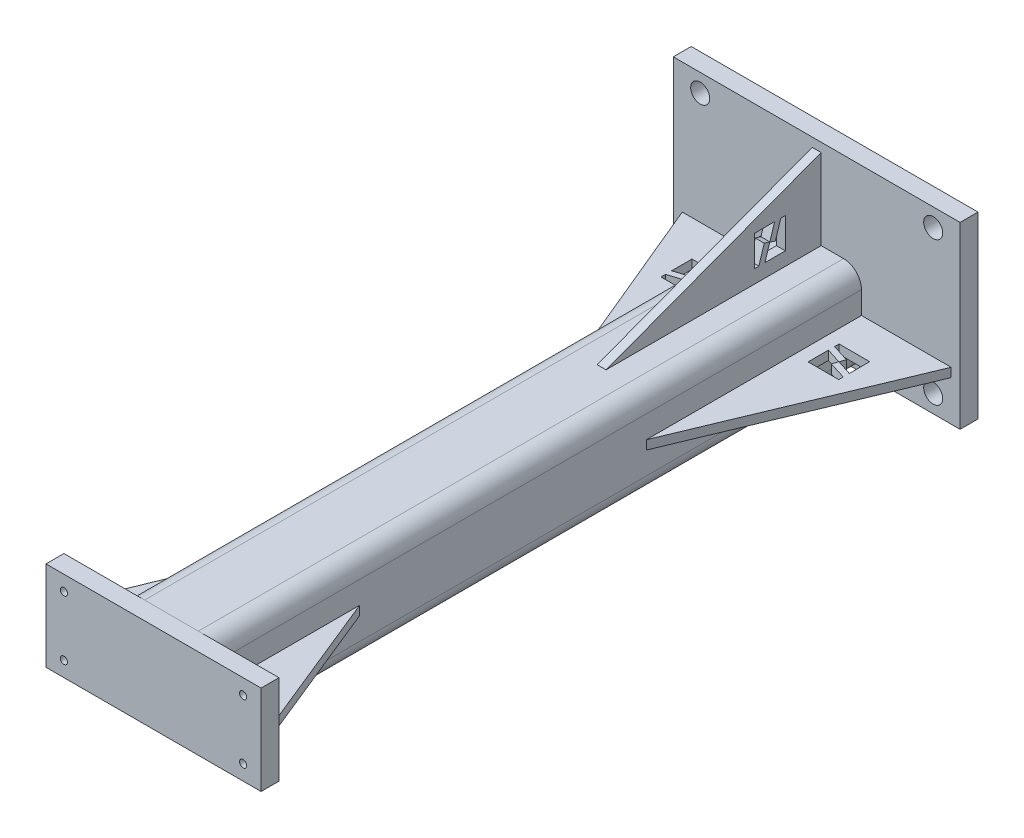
SolidWorks part; units mm, degrees
ref_plane "Front Plane" through (0, 0, 0) normal (0, 0, 1) x (1, 0, 0)
ref_plane "Top Plane" through (0, 0, 0) normal (0, 1, 0) x (1, 0, 0)
ref_plane "Right Plane" through (0, 0, 0) normal (1, 0, 0) x (0, 0, -1)
sketch3d "3DSketch1"
  line L0 (0, 0, 0) -> (0, 0, -457.2)
  dimension "D3" = 457.2
other "Tube (square) TS2.5X2.5X0.25(13)"
ref_plane "Plane1" through (0, 0, 0) normal (0, 0, -1) x (1, 0, 0)
sketch "Sketch131" plane through (0, 0, 0) normal (0, 0, -1) x (1, 0, 0)
  line L0 (-19.05, -25.4) -> (19.05, -25.4)
  line L1 (-25.4, -19.05) -> (-25.4, 19.05)
  line L2 (19.05, 25.4) -> (-19.05, 25.4)
  line L3 (25.4, 19.05) -> (25.4, -19.05)
  line L4 (-19.05, -31.75) -> (19.05, -31.75)
  line L5 (-31.75, -19.05) -> (-31.75, 19.05)
  line L6 (19.05, 31.75) -> (-19.05, 31.75)
  line L7 (31.75, 19.05) -> (31.75, -19.05)
  line L8 (-31.75, 0) -> (-25.4, 0) construction
  line L9 (-25.4, 0) -> (25.4, 0) construction
  line L10 (25.4, 0) -> (31.75, 0) construction
  line L11 (0, 31.75) -> (0, 25.4) construction
  line L12 (0, 25.4) -> (0, -25.4) construction
  line L13 (0, -25.4) -> (0, -31.75) construction
  arc A0 (31.75, 19.05) -> (19.05, 31.75) centre (19.05, 19.05) ccw
  arc A1 (19.05, -31.75) -> (31.75, -19.05) centre (19.05, -19.05) ccw
  arc A2 (-31.75, -19.05) -> (-19.05, -31.75) centre (-19.05, -19.05) ccw
  arc A3 (-19.05, 31.75) -> (-31.75, 19.05) centre (-19.05, 19.05) ccw
  arc A4 (-19.05, 25.4) -> (-25.4, 19.05) centre (-19.05, 19.05) ccw
  arc A5 (25.4, 19.05) -> (19.05, 25.4) centre (19.05, 19.05) ccw
  arc A6 (19.05, -25.4) -> (25.4, -19.05) centre (19.05, -19.05) ccw
  arc A7 (-25.4, -19.05) -> (-19.05, -25.4) centre (-19.05, -19.05) ccw
  point P6 (-31.75, -31.75)
  point P33 (-31.75, 31.75)
  point P35 (31.75, 31.75)
  point P36 (31.75, -31.75)
  point P37 (0, 0)
  dimension "D1" = 12.7
  dimension "Thickness" = 6.35
  dimension "V_leg" = 63.5
  dimension "H_leg" = 63.5
other "End cap1" [suppressed] parameters "D1"=6.35, "D2"=3.175, "D3"=3.175, "D4"=0
sketch "Sketch12" plane through (0, 0, -457.2) normal (0, 0, -1) x (-1, 0, 0)
  line L0 (0, 95.25) -> (0, -31.75) construction
  line L1 (19.05, 31.75) -> (-19.05, 31.75) construction
  line L3 (-19.05, -31.75) -> (19.05, -31.75) construction
  line L4 (-101.6, 95.25) -> (101.6, 95.25)
  line L5 (-101.6, 95.25) -> (-101.6, -31.75)
  line L6 (-101.6, -31.75) -> (101.6, -31.75)
  line L7 (101.6, 95.25) -> (101.6, -31.75)
  line L8 (-101.6, 95.25) -> (101.6, -31.75) construction
  line L9 (-101.6, -31.75) -> (101.6, 95.25) construction
  line L12 (0, 381.889) -> (0, 31.75) construction
  point P6 (0, 31.75)
  dimension "D1" = 127
  dimension "D2" = 203.2
extrude "Boss-Extrude1" add sketch "Sketch12" along normal blind 12.7 separate body
hole_wizard "1/2 Clearance Hole1" positions "Sketch13" profile "Sketch14" hole size "1/2" standard "ANSI Inch"
sketch "Sketch13" plane through (0, 0, -457.2) normal (0, 0, 1) x (1, 0, 0)
  line L0 (-101.6, 31.75) -> (299.7541, 31.75) construction
  line L1 (-101.6, -31.75) -> (-101.6, 95.25) construction
  line L3 (0, -31.75) -> (0, 201.525) construction
  line L4 (101.6, -31.75) -> (-101.6, -31.75) construction
  line L6 (-101.6, 95.25) -> (101.6, 95.25) construction
  point P0 (-82.55, 82.55)
  point P17 (-82.55, -19.05)
  point P19 (82.55, -19.05)
  point P20 (82.55, 82.55)
  dimension "D1" = 19.05
  dimension "D2" = 12.7
sketch "Sketch14" plane through (-82.55, 82.55, -457.2) normal (1, 0, 0) x (0, -1, 0)
  line L0 (0, 0) -> (0, 12.7)
  line L1 (0, 12.7) -> (6.7462, 12.7)
  line L2 (6.7462, 12.7) -> (6.7462, 0)
  line L5 (6.7462, 0) -> (0, 0)
  line L11 (0, -6.35) -> (0, 107.95) construction
  dimension "Thru Hole Dia." = 13.4925
  dimension "Thru Hole Depth" = 12.7
move or copy body "Body-Move/Copy1" [suppressed] bodies to move or copy 105 copy no translate (-31.75, 0, 0)
mirror "Mirror6" [suppressed] about plane through (0, 0, 0) normal (1, 0, 0)
other "Gusset1" parameters "D1"=6.35, "D2"=6.35, "D3"=0, "D4"=0, "D10"=6.35, "D11"=152.4, "D12"=63.5, "D13"=12.7, "D14"=67.751, "D15"=12.7, "D16"=76.2, "D17"=34.925, "D18"=24.624
sketch "Sketch132" plane through (-31.75, 0, -457.2) normal (0, -1, 0) x (-1, 0, 0)
  line L0 (0, 0) -> (0, -152.4)
  line L1 (0, 0) -> (63.5, 0)
  line L2 (0, -152.4) -> (63.5, 0)
sketch "Sketch134" plane through (0, 3.175, 0) normal (0, 1, 0) x (1, 0, 0)
  line L0 (-95.25, 457.2) -> (-31.75, 457.2) construction
  line L1 (-31.75, 457.2) -> (-31.75, 304.8) construction
  line B0 (-52.0238, 420.8344) -> (-50.8144, 416.8466)
  line B1 (-50.8144, 416.8466) -> (-62.9753, 413.011)
  line B2 (-62.9753, 413.011) -> (-62.9753, 409.814)
  line B3 (-62.9753, 409.814) -> (-41.275, 409.814)
  line B4 (-41.275, 409.814) -> (-41.275, 424.2507)
  line B5 (-41.275, 424.2507) -> (-52.0238, 420.8344)
  line B6 (-52.2366, 420.764) -> (-53.4409, 424.7518)
  line B7 (-53.4409, 424.7518) -> (-41.275, 428.5875)
  line B8 (-41.275, 428.5875) -> (-41.275, 431.8)
  line B9 (-41.275, 431.8) -> (-62.9694, 431.8)
  line B10 (-62.9694, 431.8) -> (-63.0073, 417.3555)
  line B11 (-63.0073, 417.3555) -> (-52.2366, 420.764)
  dimension "D1" = 25.4
  dimension "D2" = 9.525
sketch_block_instance "Block2-1"
sketch_block "Block2"
extrude "Cut-Extrude1" cut sketch "Sketch134" against normal through all
other "Gusset2" parameters "D1"=6.35, "D2"=6.35, "D3"=0, "D4"=0, "D10"=6.35, "D11"=152.4, "D12"=57.15, "D13"=12.7, "D14"=74.745, "D15"=12.7, "D16"=76.2, "D17"=31.75, "D18"=22.62
sketch "Sketch133" plane through (0, 31.75, -457.2) normal (-1, 0, 0) x (0, 0, 1)
  line L0 (0, 0) -> (152.4, 0)
  line L1 (0, 0) -> (0, 57.15)
  line L2 (152.4, 0) -> (0, 57.15)
sketch "Sketch135" plane through (-3.175, 0, 0) normal (-1, 0, 0) x (0, 0, 1)
  line L0 (-457.2, 88.9) -> (-457.2, 31.75) construction
  line L1 (-457.2, 31.75) -> (-304.8, 31.75) construction
  line B0 (-420.7796, 52.0238) -> (-424.7675, 50.8144)
  line B1 (-424.7675, 50.8144) -> (-428.6031, 62.9753)
  line B2 (-428.6031, 62.9753) -> (-431.8, 62.9753)
  line B3 (-431.8, 62.9753) -> (-431.8, 41.275)
  line B4 (-431.8, 41.275) -> (-417.3633, 41.275)
  line B5 (-417.3633, 41.275) -> (-420.7796, 52.0238)
  line B6 (-420.8501, 52.2366) -> (-416.8622, 53.4409)
  line B7 (-416.8622, 53.4409) -> (-413.0266, 41.275)
  line B8 (-413.0266, 41.275) -> (-409.814, 41.275)
  line B9 (-409.814, 41.275) -> (-409.814, 62.9694)
  line B10 (-409.814, 62.9694) -> (-424.2585, 63.0073)
  line B11 (-424.2585, 63.0073) -> (-420.8501, 52.2366)
  dimension "D1" = 25.4
  dimension "D2" = 9.525
sketch_block_instance "Block2-2"
extrude "Cut-Extrude2" cut sketch "Sketch135" against normal through all
ref_plane "Plane2" through (0, 0, 0) normal (-1, 0, 0) x (0, 0, 1)
mirror "Mirror3" about plane through (0, 0, 0) normal (-1, 0, 0)
sketch "Sketch136" plane through (0, 0, 0) normal (0, 0, 1) x (1, 0, 0)
  line L0 (-19.05, 31.75) -> (19.05, 31.75) construction
  line L1 (19.05, -31.75) -> (-19.05, -31.75) construction
  line L2 (0, -25.4) -> (0, -31.75) construction
  line L3 (19.05, -25.4) -> (-19.05, -25.4) construction
  line L8 (-76.2, 31.75) -> (-76.2, -31.75)
  line L9 (-76.2, -31.75) -> (76.2, -31.75)
  line L10 (76.2, -31.75) -> (76.2, 31.75)
  line L11 (76.2, 31.75) -> (-76.2, 31.75)
  dimension "D1" = 152.4
extrude "Boss-Extrude2" add sketch "Sketch136" along normal blind 12.7 separate body
hole_wizard "#10 Clearance Hole1" positions "Sketch137" profile "Sketch138" hole size "#10" standard "ANSI Inch"
sketch "Sketch137" plane through (0, 0, 0) normal (0, 0, -1) x (-1, 0, 0)
  line L0 (63.5, 21.0312) -> (-76.2, 21.0312) construction
  line L2 (-76.2, 26.1112) -> (-76.2, 15.9512) construction
  line L3 (-76.2, -21.0312) -> (63.5, -21.0312) construction
  line L5 (-76.2, -15.9512) -> (-76.2, -26.1112) construction
  line L6 (63.5, 21.0312) -> (63.5, -21.0312) construction
  line L8 (76.2, 31.75) -> (76.2, -31.75) construction
  point P0 (63.5, 21.0312)
  point P2 (63.5, -21.0312)
  dimension "D1" = 12.7
sketch "Sketch138" plane through (-63.5, 21.0312, 0) normal (1, 0, 0) x (0, 1, 0)
  line L0 (0, 0) -> (0, 12.7)
  line L1 (0, 12.7) -> (2.5527, 12.7)
  line L2 (2.5527, 12.7) -> (2.5527, 0)
  line L5 (2.5527, 0) -> (0, 0)
  line L11 (0, -6.35) -> (0, 107.95) construction
  dimension "Thru Hole Dia." = 5.1054
  dimension "Thru Hole Depth" = 12.7
mirror "Mirror4" about plane through (0, 0, 0) normal (-1, 0, 0) of "#10 Clearance Hole1"
move or copy body "Body-Move/Copy2" [suppressed] bodies to move or copy 135 copy no translate (28.575, 0, 0)
sketch "Sketch139" plane through (0, 0, 0) normal (0, 1, 0) x (1, 0, 0)
  line L0 (66.0527, 0) -> (60.9473, 0) construction
  line L1 (73.025, 0) -> (31.75, 101.6)
  line L2 (76.2, -12.7) -> (76.2, 0) construction
  line L3 (31.75, 457.2) -> (31.75, 0) construction
  line L4 (73.025, 0) -> (31.75, 0)
  line L5 (31.75, 0) -> (31.75, 101.6)
  dimension "D1" = 3.175
  dimension "D2" = 101.6
extrude "Boss-Extrude3" add sketch "Sketch139" along normal mid plane 6.35 separate body
mirror "Mirror5" about plane through (0, 0, 0) normal (-1, 0, 0)
hole_wizard "1/4-20 Tapped Hole1" positions "Sketch140" profile "Sketch141" tap size "1/4-20" standard "ANSI Inch"
sketch "Sketch140" plane through (0, 0, 12.7) normal (0, 0, 1) x (1, 0, 0)
  point P0 (69.3356, -22.6187)
  point P3 (147.9105, -22.6187)
  point P6 (147.9105, 22.6187)
  point P9 (69.3356, 22.6187)
  point P12 (-75.6857, -22.6187)
  point P15 (-75.6857, 22.6187)
  point P18 (-154.2606, -22.6187)
  point P27 (-154.2606, 22.6187)
sketch "Sketch141" plane through (69.3356, -22.6187, 12.7) normal (1, 0, 0) x (0, -1, 0)
  line L0 (0, 0) -> (0, 482.6)
  line L1 (0, 482.6) -> (2.5527, 482.6)
  line L2 (2.5527, 482.6) -> (2.5527, 0)
  line L5 (2.5527, 0) -> (0, 0)
  line L11 (0, -6.35) -> (0, 107.95) construction
  dimension "Thru Tap Drill Dia." = 5.1054
  dimension "Thru Tap Drill Depth" = 482.6
delete or keep bodies "Body-Delete/Keep 1" [suppressed] type delete bodies bodies 137 138 139
sketch "Sketch142" [suppressed] plane through (0, -31.75, 0) normal (0, 1, 0) x (1, 0, 0)
  line L0 (-19.05, 0) -> (19.05, 0) construction
  line L1 (50.8, 0) -> (-50.8, 0)
  line L2 (50.8, 0) -> (50.8, 210.6422)
  line L3 (50.8, 210.6422) -> (-50.8, 210.6422)
  line L4 (-50.8, 0) -> (-50.8, 210.6422)
  line L5 (50.8, 0) -> (-50.8, 210.6422) construction
  line L6 (50.8, 210.6422) -> (-50.8, 0) construction
  line L7 (0, 105.3211) -> (0, 0) construction
  line L8 (19.05, 0) -> (-19.05, 0) construction
  point P0 (0, 105.3211)
  dimension "D1" = 210.6422
  dimension "D2" = 101.6
extrude "Boss-Extrude4" [suppressed] add sketch "Sketch142" against normal blind 12.7 separate body
other "End cap2" [suppressed] parameters "D1"=6.35, "D2"=3.175, "D3"=3.175, "D4"=0
hole_wizard "#10 Clearance Hole2" positions "Sketch143" profile "Sketch144" hole size "#10" standard "ANSI Inch"
sketch "Sketch143" plane through (0, -31.75, 0) normal (0, 1, 0) x (1, 0, 0)
  line L0 (-50.8, 6.7628) -> (-41.275, 6.7628) construction
  line L2 (-50.8, 48.8252) -> (-41.275, 48.8252) construction
  line L4 (-50.8, 53.9052) -> (-50.8, 43.7452) construction
  line L5 (-50.8, 11.8428) -> (-50.8, 1.6828) construction
  line L7 (-41.275, 6.7628) -> (-41.275, 48.8252) construction
  line L9 (-50.8, 105.3211) -> (-102.5494, 105.3211) construction
  line L10 (-50.8, 210.6422) -> (-50.8, 0) construction
  line L12 (0, 0) -> (0, -123.7907) construction
  line L13 (19.05, 0) -> (-19.05, 0) construction
  line L14 (-41.275, 27.794) -> (-50.8, 27.794) construction
  line L16 (-41.275, 27.794) -> (-31.75, 27.794) construction
  line L18 (-31.75, 762) -> (-31.75, 0) construction
  point P0 (-41.275, 6.7628)
  point P6 (-41.275, 48.8252)
  point P33 (-41.275, 203.8794)
  point P34 (-41.275, 161.817)
  point P42 (41.275, 203.8794)
  point P43 (41.275, 161.817)
  point P44 (41.275, 48.8252)
  point P45 (41.275, 6.7628)
sketch "Sketch144" plane through (-41.275, -31.75, -6.7628) normal (1, 0, 0) x (0, 0, 1)
  line L0 (0, 0) -> (0, 12.7)
  line L1 (0, 12.7) -> (2.5527, 12.7)
  line L2 (2.5527, 12.7) -> (2.5527, 0)
  line L5 (2.5527, 0) -> (0, 0)
  line L11 (0, -6.35) -> (0, 107.95) construction
  dimension "Thru Hole Dia." = 5.1054
  dimension "Thru Hole Depth" = 12.7
hole_wizard "1/4-20 Tapped Hole2" positions "Sketch145" profile "Sketch146" tap size "1/4-20" standard "ANSI Inch"
sketch "Sketch145" plane through (0, -44.45, 0) normal (0, -1, 0) x (-1, 0, 0)
  point P0 (22.6187, 67.0814)
  point P3 (-22.6187, 67.0814)
  point P6 (-22.6187, 143.5735)
  point P9 (22.6187, 143.5735)
sketch "Sketch146" plane through (-22.6187, -44.45, -67.0814) normal (1, 0, 0) x (0, 0, -1)
  line L0 (0, 0) -> (0, 139.7)
  line L1 (0, 139.7) -> (2.5527, 139.7)
  line L2 (2.5527, 139.7) -> (2.5527, 0)
  line L5 (2.5527, 0) -> (0, 0)
  line L11 (0, -6.35) -> (0, 107.95) construction
  dimension "Thru Tap Drill Dia." = 5.1054
  dimension "Thru Tap Drill Depth" = 139.7
sketch "Sketch147" [suppressed] plane through (0, -44.45, 0) normal (0, -1, 0) x (-1, 0, 0)
  line L0 (6.35, 65.3542) -> (6.35, 145.3007) construction
  line L1 (6.604, 77.0001) -> (-6.604, 77.0001)
  line L2 (6.604, 77.0001) -> (6.604, 133.6548)
  line L3 (6.604, 133.6548) -> (-6.604, 133.6548)
  line L4 (-6.604, 77.0001) -> (-6.604, 133.6548)
  line L5 (-6.35, 65.3542) -> (-6.35, 145.3007) construction
  line L6 (-28.575, 78.5876) -> (28.575, 78.5876) construction
  line L7 (28.575, 132.0673) -> (-28.575, 132.0673) construction
  dimension "D1" = 0.254
  dimension "D2" = 0.254
  dimension "D3" = 1.5875
  dimension "D4" = 1.5875
extrude "Cut-Extrude3" [suppressed] cut sketch "Sketch147" against normal up to surface (19.05 mm away)
fillet "Fillet1" [suppressed] radius 1.5875
mirror "Mirror7" [suppressed] about plane through (0, 0, 0) normal (1, 0, 0)
sketch "Sketch148" [suppressed] plane through (0, -3.175, 0) normal (0, -1, 0) x (1, 0, 0)
  line L0 (0, 0) -> (-156.2354, 0) construction
  line L1 (-63.5, 0) -> (63.5, 0)
  line L2 (-63.5, 0) -> (-63.5, -228.6)
  line L3 (-63.5, -228.6) -> (63.5, -228.6)
  line L4 (63.5, 0) -> (63.5, -228.6)
  line L5 (-63.5, -457.2) -> (-63.5, 0) construction
  line L6 (63.5, -457.2) -> (63.5, 0) construction
  line L7 (-63.5, -457.2) -> (-63.5, 0) construction
extrude "Cut-Extrude4" [suppressed] cut sketch "Sketch148" against normal through all
sketch "Sketch149" [suppressed] plane through (0, 0, 0) normal (0, 0, 1) x (1, 0, 0)
  line L1 (-12.7, 31.75) -> (12.7, 31.75)
  line L2 (-12.7, 31.75) -> (-12.7, -31.75)
  line L3 (-12.7, -31.75) -> (12.7, -31.75)
  line L4 (12.7, 31.75) -> (12.7, -31.75)
extrude "Cut-Extrude5" [suppressed] cut sketch "Sketch149" against normal up to surface (457.2 mm away)
sketch "Sketch150" [suppressed] plane through (0, 0, 0) normal (0, 0, 1) x (1, 0, 0)
  line L1 (-12.7, 31.75) -> (12.7, 31.75)
  line L2 (-12.7, 31.75) -> (-12.7, 25.4)
  line L3 (-12.7, 25.4) -> (12.7, 25.4)
  line L4 (12.7, 31.75) -> (12.7, 25.4)
  line L5 (-12.7, -25.4) -> (12.7, -25.4)
  line L6 (-12.7, -25.4) -> (-12.7, -31.75)
  line L7 (-12.7, -31.75) -> (12.7, -31.75)
  line L8 (12.7, -25.4) -> (12.7, -31.75)
extrude "Boss-Extrude5" [suppressed] add sketch "Sketch150" against normal up to surface (457.2 mm away)
delete or keep bodies "Body-Delete/Keep 2" [suppressed] type keep bodies bodies 137
